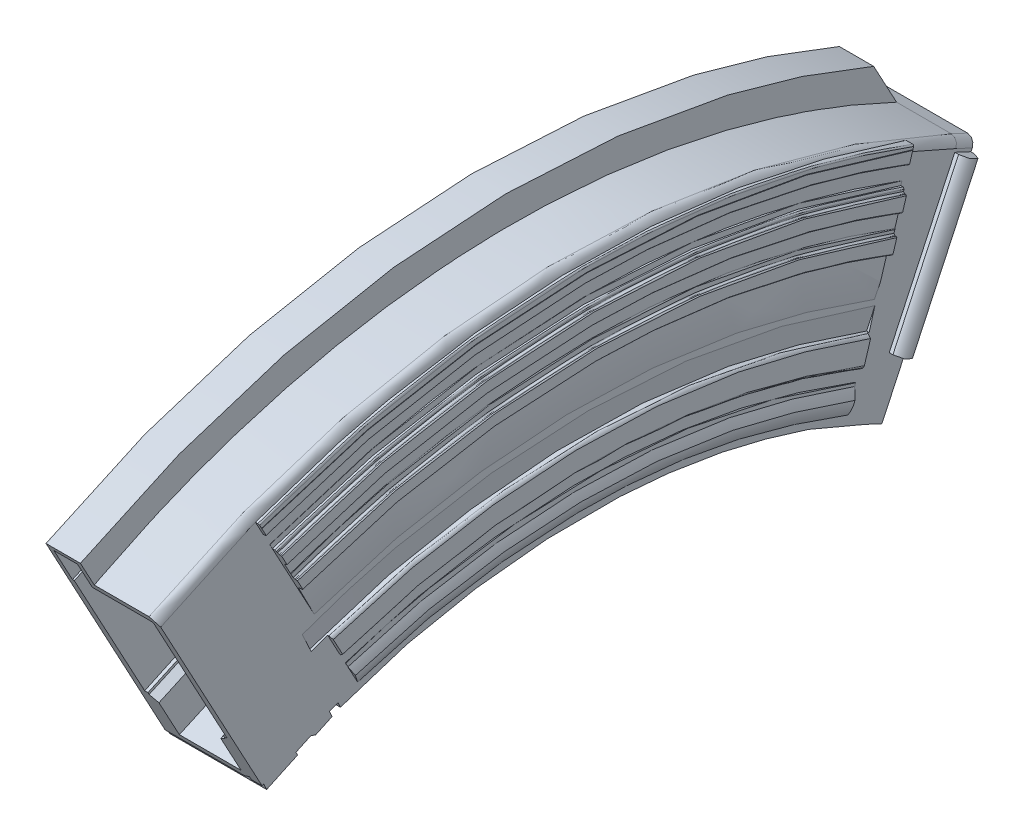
SolidWorks part; units mm, degrees
ref_plane "Front Plane" through (0, 0, 0) normal (0, 0, 1) x (1, 0, 0)
ref_plane "Top Plane" through (0, 0, 0) normal (0, 1, 0) x (1, 0, 0)
ref_plane "Right Plane" through (0, 0, 0) normal (1, 0, 0) x (0, 0, -1)
imported_body "Imported1"
ref_plane "Plane1" through (-25.3777, 0, 0) normal (-1, 0, 0) x (0, 0, 1)
sketch "Sketch1" plane through (-25.3777, 0, 0) normal (-1, 0, 0) x (0, 0, 1)
  line L0 (-115.4013, 84.4642) -> (-62.3327, -24.4482)
  line L1 (85.879, 84.4642) -> (-115.4013, 84.4642)
  line L5 (-62.3327, -24.4482) -> (67.0618, -25.7167)
  line L6 (67.0618, -25.7167) -> (85.879, 84.4642)
extrude "Cut-Extrude2" cut sketch "Sketch1" along normal blind 10
ref_plane "Plane2" through (1.5022, 0, 0) normal (1, 0, 0) x (0, 0, -1)
sketch "Sketch2" plane through (1.5022, 0, 0) normal (1, 0, 0) x (0, 0, -1)
  line L4 (62.3327, -24.4482) -> (115.4013, 84.4642)
  line L5 (-67.0618, -25.7167) -> (62.3327, -24.4482)
  line L6 (-85.879, 84.4642) -> (-67.0618, -25.7167)
  line L7 (115.4013, 84.4642) -> (-85.879, 84.4642)
  line L8 (62.3327, -24.4482) -> (115.4013, 84.4642)
  line L9 (-67.0618, -25.7167) -> (62.3327, -24.4482)
  line L10 (-85.879, 84.4642) -> (-67.0618, -25.7167)
  line L11 (115.4013, 84.4642) -> (-85.879, 84.4642)
  dimension "D1" = 0
extrude "Cut-Extrude3" cut sketch "Sketch2" along normal blind 10
ref_plane "Plane3" through (0, -37.4613, 69.5022) normal (0, -0.4745, 0.8803) x (1, 0, 0)
sketch "Sketch3" plane through (0, -37.4613, 69.5022) normal (0, -0.4745, 0.8803) x (1, 0, 0)
  line L1 (-25.3777, 97.7914) -> (-25.3777, 108.1915)
  line L3 (-25.3777, 108.1915) -> (-15.8527, 108.1915)
  line L4 (-15.8527, 100.0635) -> (-15.8527, 108.1915)
  line L5 (-15.8527, 100.0635) -> (-21.7243, 100.0635)
  line L7 (-16.4978, 100.0635) -> (-7.4978, 100.0635) construction
  line L9 (-21.7243, 100.0635) -> (-25.3777, 97.7914)
  dimension "D2" = 8.128
sketch "Sketch4" plane through (-25.3777, 0, 0) normal (-1, 0, 0) x (0, 0, 1)
  spline S0 degree 2 poles (217.5222, -1918.3619) (528.5417, -111.1256) (90.5708, 60.2304) (77.3085, 65.4192) (63.5341, 69.0398) (49.5686, 72.7106) (35.2681, 74.7187) (20.8682, 76.7408) (6.3292, 77.0486) (-8.2087, 77.3564) (-22.6823, 75.9455) (-37.054, 74.5445) (-51.1633, 71.4679) (-65.0776, 68.4338) (-78.5486, 63.8105) (-523.2936, -88.8257) (-290.1986, -1907.5429) knots -4.08802 -4.08802 -4.08802 0.125 0.125 0.25 0.25 0.375 0.375 0.5 0.5 0.625 0.625 0.75 0.75 0.875 0.875 5.087357 5.087357 5.087357 only from (115.9006, 48.622) to (-104.347, 53.2846) construction
  spline S1 degree 2 poles (115.9006, 48.622) (103.5654, 55.1462) (90.5708, 60.2304) (77.3085, 65.4192) (63.5341, 69.0398) (49.5686, 72.7106) (35.2681, 74.7187) (20.8682, 76.7408) (6.3292, 77.0486) (-8.2087, 77.3564) (-22.6823, 75.9455) (-37.054, 74.5445) (-51.1633, 71.4679) (-65.0776, 68.4338) (-78.5486, 63.8105) (-91.7463, 59.2811) (-104.347, 53.2846) knots 0 0 0 0.125 0.125 0.25 0.25 0.375 0.375 0.5 0.5 0.625 0.625 0.75 0.75 0.875 0.875 1 1 1
sketch "Sketch5" plane through (-25.3777, 0, 0) normal (-1, 0, 0) x (0, 0, 1)
  line L0 (84.8407, 64.8058) -> (80.7077, 78.045)
  line L1 (80.7077, 78.045) -> (122.1902, 60.5092)
  line L2 (122.1902, 60.5092) -> (116.9787, 50.6222)
  arc A0 (116.9787, 50.6222) -> (84.8407, 64.8058) centre (1.134, -168.3638) ccw construction
  arc A1 (116.9787, 50.6222) -> (84.8407, 64.8058) centre (1.134, -168.3638) ccw
extrude "Cut-Extrude4" cut sketch "Sketch5" against normal through all
sweep "Sweep4" add profiles "Sketch3" path "Sketch4"
sketch "Sketch6" plane through (0, 0, 0) normal (1, 0, 0) x (0, 0, -1)
  line L0 (105.3073, 55.3439) -> (95.5176, 73.5067)
  line L1 (95.5176, 73.5067) -> (106.293, 79.3146)
  line L2 (106.293, 79.3146) -> (116.0827, 61.1518)
  line L3 (116.0827, 61.1518) -> (105.3073, 55.3439)
  line L4 (-95.4937, 10.7609) -> (-120.8351, 57.777) construction
extrude "Cut-Extrude5" cut sketch "Sketch6" against normal through all
sketch "Sketch7" plane through (0, -37.4613, 69.5022) normal (0, -0.4745, 0.8803) x (1, 0, 0)
  line L0 (-23.8777, 106.6915) -> (-23.8777, 95.8673)
  line L2 (-17.3527, 95.8673) -> (-17.3527, 106.6915)
  line L4 (-17.3527, 106.6915) -> (-23.8777, 106.6915)
  line L6 (-17.3527, 95.8673) -> (-23.8777, 95.8673)
sketch "Sketch8" plane through (-25.3777, 0, 0) normal (-1, 0, 0) x (0, 0, 1)
  line L0 (120.1234, 56.4566) -> (114.9877, 46.9283) construction
  line L1 (120.1234, 56.4566) -> (114.9877, 46.9283)
  spline S1 degree 3 poles (120.1234, 56.4566) (107.2655, 63.2573) (80.5993, 74.635) (36.7411, 84.9413) (-11.3824, 87.5216) (-58.0414, 80.8774) (-87.1955, 71.1129) (-99.6719, 65.7992) knots 0 0 0 0 0.186667 0.373333 0.56 0.78 0.954113 0.954113 0.954113 0.954113
ref_plane "Plane4" through (-23.8777, 0, 0) normal (-1, 0, 0) x (0, 0, 1)
sketch "Sketch9" plane through (-23.8777, 0, 0) normal (-1, 0, 0) x (0, 0, 1)
  spline S0 degree 3 poles (1467.1093, -1414.6889) (381.43, -552.1429) (356.3336, 9.8397) (36.7411, 84.9413) (-11.3824, 87.5216) (-373.1738, 36.0027) (-419.0478, -643.8914) (-1314.4878, -1520.7567) knots -3.520692 -3.520692 -3.520692 -3.520692 0.186667 0.373333 0.56 0.78 4.876664 4.876664 4.876664 4.876664 only from (120.1234, 56.4566) to (-99.6719, 65.7992) construction
  spline S1 degree 3 poles (120.1234, 56.4566) (107.2655, 63.2573) (80.5993, 74.635) (36.7411, 84.9413) (-11.3824, 87.5216) (-58.0414, 80.8774) (-87.1955, 71.1129) (-99.6719, 65.7992) knots 0 0 0 0 0.186667 0.373333 0.56 0.78 0.954113 0.954113 0.954113 0.954113
sweep "Cut-Sweep3" cut profiles "Sketch7" path "Sketch9"
sketch "Sketch10" plane through (-25.3777, 0, 0) normal (-1, 0, 0) x (0, 0, 1)
  line L0 (-89.3496, 9.2915) -> (-84.6828, -0.7164) construction
  line L1 (70.0327, 6.9164) -> (68.4385, 3.4898) construction
  line L2 (68.4385, 3.4898) -> (72.9948, 1.37) construction
  line L3 (72.9948, 1.37) -> (74.3738, 1.8181) construction
  line L4 (74.3738, 1.8181) -> (78.454, -0.0798) construction
  line L5 (78.454, -0.0798) -> (78.0357, -0.9791) construction
  line L6 (78.0357, -0.9791) -> (86.5796, -4.9532) construction
  line L7 (86.5796, -4.9532) -> (87.3962, -3.1977) construction
  line L8 (87.8437, -3.4322) -> (93.9759, 7.945) construction
  line L9 (93.9759, 7.945) -> (94.7377, 9.3584) construction
  line L10 (-85.9155, 13.631) -> (-86.2185, 14.2807) construction
  line L11 (-90.3077, 11.5829) -> (-85.9155, 13.631) construction
  line L12 (-90.5661, 12.137) -> (-90.3077, 11.5829) construction
  line L13 (-90.5661, 12.137) -> (-90.6553, 12.0916) construction
  line L14 (-90.6553, 12.0916) -> (-90.1912, 11.0964) construction
  line L15 (94.7377, 9.3584) -> (95.4937, 10.7609) construction
  line L16 (-90.1912, 11.0964) -> (-89.3496, 9.2915) construction
  line L17 (-89.3496, 9.2915) -> (-84.6828, -0.7164)
  line L18 (70.0327, 6.9164) -> (68.4385, 3.4898)
  line L19 (68.4385, 3.4898) -> (72.9948, 1.37)
  line L20 (72.9948, 1.37) -> (74.3738, 1.8181)
  line L21 (74.3738, 1.8181) -> (78.454, -0.0798)
  line L22 (78.454, -0.0798) -> (78.0357, -0.9791)
  line L23 (78.0357, -0.9791) -> (86.5796, -4.9532)
  line L24 (86.5796, -4.9532) -> (87.3962, -3.1977)
  line L25 (87.8437, -3.4322) -> (93.9759, 7.945)
  line L26 (93.9759, 7.945) -> (94.7377, 9.3584)
  line L27 (-85.9155, 13.631) -> (-86.2185, 14.2807)
  line L28 (-90.3077, 11.5829) -> (-85.9155, 13.631)
  line L29 (-90.5661, 12.137) -> (-90.3077, 11.5829)
  line L30 (-90.5661, 12.137) -> (-90.6553, 12.0916)
  line L31 (-90.6553, 12.0916) -> (-90.1912, 11.0964)
  line L32 (94.7377, 9.3584) -> (95.4937, 10.7609)
  line L33 (-90.1912, 11.0964) -> (-89.3496, 9.2915)
  arc A0 (87.8437, -3.4322) -> (87.3962, -3.1977) centre (1.134, -168.3638) ccw construction
  arc A1 (87.8437, -3.4322) -> (87.3962, -3.1977) centre (1.134, -168.3638) ccw
  spline S0 degree 2 poles (-200.8077, -1973.8386) (-448.4512, -148.8292) (-70.172, 5.9531) (-59.096, 10.4852) (-47.5026, 13.5834) (-28.1453, 18.7564) (-8.1461, 19.7432) (11.8512, 20.7298) (31.6255, 17.4871) (41.483, 15.8706) (51.1012, 13.224) (448.0782, -96.0109) (362.0888, -1947.6196) knots -5.029672 -5.029672 -5.029672 0.1 0.1 0.25 0.25 0.5 0.5 0.75 0.75 0.875 0.875 6.040096 6.040096 6.040096 only from (-84.6828, -0.7164) to (70.0327, 6.9164) construction
  spline S1 degree 2 poles (98.5134, -1962.4991) (477.82, -135.3858) (74.0561, 20.5054) (63.0235, 24.765) (51.5667, 27.7123) (40.202, 30.636) (28.5654, 32.2273) (16.8648, 33.8273) (5.0505, 34.0563) (-6.7627, 34.2852) (-18.5116, 33.139) (-30.2066, 31.9981) (-41.6673, 29.5186) (-53.225, 27.0182) (-64.4101, 23.191) (-473.0677, -116.6383) (-181.5903, -1956.8715) knots -4.45908 -4.45908 -4.45908 0.125 0.125 0.25 0.25 0.375 0.375 0.5 0.5 0.625 0.625 0.75 0.75 0.875 0.875 5.450003 5.450003 5.450003 only from (95.4937, 10.7609) to (-86.2185, 14.2807) construction
  spline S2 degree 2 poles (-84.6828, -0.7164) (-77.5464, 2.9357) (-70.172, 5.9531) (-59.096, 10.4852) (-47.5026, 13.5834) (-28.1453, 18.7564) (-8.1461, 19.7432) (11.8512, 20.7298) (31.6255, 17.4871) (41.483, 15.8706) (51.1012, 13.224) (60.7084, 10.5804) (70.0327, 6.9164) knots 0 0 0 0.1 0.1 0.25 0.25 0.5 0.5 0.75 0.75 0.875 0.875 1 1 1
  spline S3 degree 2 poles (95.4937, 10.7609) (85.066, 16.2545) (74.0561, 20.5054) (63.0235, 24.765) (51.5667, 27.7123) (40.202, 30.636) (28.5654, 32.2273) (16.8648, 33.8273) (5.0505, 34.0563) (-6.7627, 34.2852) (-18.5116, 33.139) (-30.2066, 31.9981) (-41.6673, 29.5186) (-53.225, 27.0182) (-64.4101, 23.191) (-75.5756, 19.3705) (-86.2185, 14.2807) knots 0 0 0 0.125 0.125 0.25 0.25 0.375 0.375 0.5 0.5 0.625 0.625 0.75 0.75 0.875 0.875 1 1 1
extrude "Boss-Extrude1" add sketch "Sketch10" against normal up to surface (2.9058 mm away)
sketch "Sketch11" plane through (1.5022, 0, 0) normal (1, 0, 0) x (0, 0, -1)
  line L0 (-87.8435, -3.4325) -> (-95.5279, 10.8244)
  line L1 (83.8874, -2.4221) -> (90.7114, 12.2119)
  line L2 (79.3556, -0.3097) -> (83.8874, -2.4221)
  line L3 (-78.0357, -0.9791) -> (-78.454, -0.0798) construction
  line L4 (-78.454, -0.0798) -> (-74.3738, 1.8181) construction
  line L5 (-74.3738, 1.8181) -> (-72.9948, 1.37) construction
  line L6 (-72.9948, 1.37) -> (-68.4385, 3.4898) construction
  line L8 (-87.8574, -2.2061) -> (-86.5796, -4.9532) construction
  line L9 (-86.5796, -4.9532) -> (-78.0357, -0.9791) construction
  line L10 (-87.8435, -3.4325) -> (-87.396, -3.1981)
  line L11 (-69.1872, 5.0991) -> (-68.4385, 3.4898)
  line L26 (-78.0357, -0.9791) -> (-78.454, -0.0798)
  line L27 (-78.454, -0.0798) -> (-74.3738, 1.8181)
  line L28 (-74.3738, 1.8181) -> (-72.9948, 1.37)
  line L29 (-72.9948, 1.37) -> (-68.4385, 3.4898)
  line L31 (-87.396, -3.1981) -> (-86.5796, -4.9532)
  line L32 (-86.5796, -4.9532) -> (-78.0357, -0.9791)
  line L34 (90.7114, 12.2119) -> (86.2489, 14.3461)
  spline S0 degree 3 poles (1622.9384, -883.8935) (-402.81, -635.4754) (-297.3004, -56.6568) (-34.8478, 15.6256) (-18.5107, 17.88) (14.1899, 18.0601) (30.5508, 15.9857) (293.5161, -53.3314) (405.4192, -629.7756) (-1610.6775, -900.857) knots -3.741914 -3.741914 -3.741914 -3.741914 0.170403 0.170403 0.420403 0.420403 0.670403 0.670403 4.578491 4.578491 4.578491 4.578491 weights 1 1 1 1 1 1 1 1 1 1 only from (-69.1872, 5.0991) to (79.3556, -0.3097) construction
  spline S2 degree 3 poles (69.8559, -1957.0512) (329.8702, -796.8684) (352.2471, -93.7745) (71.26, 20.8376) (67.0965, 22.3794) (58.6348, 25.1977) (54.338, 26.4723) (41.4321, 29.8424) (32.7458, 31.5079) (15.212, 33.6989) (6.3644, 34.2245) (-7.032, 34.1298) (-11.5009, 33.9496) (-20.3572, 33.3009) (-24.7578, 32.8324) (-37.8789, 31.001) (-46.5185, 29.2142) (-59.3153, 25.68) (-63.5537, 24.3592) (-71.9749, 21.4254) (-76.1566, 19.8113) (-383.7759, -110.7286) (-288.4616, -941.1838) (-81.1689, -1964.1016) knots -4.121511 -4.121511 -4.121511 -4.121511 0.101632 0.101632 0.164132 0.164132 0.226632 0.226632 0.351632 0.351632 0.476632 0.476632 0.539132 0.539132 0.601632 0.601632 0.726632 0.726632 0.789132 0.789132 0.851632 0.851632 5.486098 5.486098 5.486098 5.486098 weights 1 1 1 1 1 1 1 1 1 1 1 1 1 1 1 1 1 1 1 1 1 1 1 1 only from (86.2489, 14.3461) to (-95.5279, 10.8244) construction
  spline S4 degree 3 poles (-69.1872, 5.0991) (-63.1093, 7.4841) (-56.9063, 9.5505) (-34.8478, 15.6256) (-18.5107, 17.88) (14.1899, 18.0601) (30.5508, 15.9857) (57.7087, 8.827) (68.7711, 4.758) (79.3556, -0.3097) knots 0.07057 0.07057 0.07057 0.07057 0.170403 0.170403 0.420403 0.420403 0.670403 0.670403 0.849833 0.849833 0.849833 0.849833 weights 1 1 1 1 1 1 1 1 1 1
  spline S6 degree 3 poles (86.2489, 14.3461) (82.6714, 16.057) (79.0411, 17.6638) (71.26, 20.8376) (67.0965, 22.3794) (58.6348, 25.1977) (54.338, 26.4723) (41.4321, 29.8424) (32.7458, 31.5079) (15.212, 33.6989) (6.3644, 34.2245) (-7.032, 34.1298) (-11.5009, 33.9496) (-20.3572, 33.3009) (-24.7578, 32.8324) (-37.8789, 31.001) (-46.5185, 29.2142) (-59.3153, 25.68) (-63.5537, 24.3592) (-71.9749, 21.4254) (-76.1566, 19.8113) (-85.4596, 15.8635) (-90.5518, 13.446) (-95.5279, 10.8244) knots 0.045455 0.045455 0.045455 0.045455 0.101632 0.101632 0.164132 0.164132 0.226632 0.226632 0.351632 0.351632 0.476632 0.476632 0.539132 0.539132 0.601632 0.601632 0.726632 0.726632 0.789132 0.789132 0.851632 0.851632 0.931178 0.931178 0.931178 0.931178 weights 1 1 1 1 1 1 1 1 1 1 1 1 1 1 1 1 1 1 1 1 1 1 1 1
extrude "Boss-Extrude3" add sketch "Sketch11" against normal up to surface (2.974 mm away)
ref_plane "Plane5" through (0, -24.4829, 52.6227) normal (0, 0.4218, -0.9067) x (-1, 0, 0)
sketch "Sketch12" plane through (0, -24.4829, 52.6227) normal (0, 0.4218, -0.9067) x (-1, 0, 0)
  line L0 (11.9378, 32.0311) -> (11.9378, 129.7323) construction
  line L1 (25.3777, 32.0311) -> (-1.5022, 32.0311) construction
  line L2 (-1.5022, 32.0337) -> (-1.5022, 33.8087) construction
  line L3 (-1.5022, 32.0337) -> (-1.5022, 33.8087)
  line L4 (-1.5022, 50.1111) -> (-1.5022, 33.9431) construction
  line L5 (-1.5022, 40.9334) -> (-1.5022, 44.1084)
  line L6 (-1.5022, 58.9674) -> (-1.9825, 63.0338)
  line L7 (-1.5022, 93.047) -> (-1.5022, 50.1111) construction
  line L8 (-0.7522, 52.6174) -> (-1.7522, 52.6174)
  line L9 (-2.7522, 51.6174) -> (-2.7522, 45.1084)
  line L10 (-1.7522, 44.1084) -> (-1.5022, 44.1084)
  line L11 (-0.7522, 52.6174) -> (-1.5022, 58.9674)
  line L12 (-1.5022, 93.047) -> (-2.1522, 93.047)
  line L13 (-2.5022, 92.697) -> (-2.5022, 88.952)
  line L14 (-2.1522, 88.602) -> (-1.5022, 88.602)
  line L15 (-1.5022, 88.602) -> (-1.5022, 84.792)
  line L16 (-1.5022, 84.792) -> (-2.1522, 84.792)
  line L17 (-2.5022, 84.442) -> (-2.5022, 83.9783)
  line L18 (-2.8522, 83.6283) -> (-3.1522, 83.6283)
  line L19 (-3.5022, 83.2783) -> (-3.5022, 78.8983)
  line L20 (-3.1522, 78.5483) -> (-2.8522, 78.5483)
  line L21 (-2.5022, 78.1983) -> (-2.5022, 74.8343)
  line L22 (-2.8522, 74.4843) -> (-3.1522, 74.4843)
  line L23 (-3.5022, 74.1343) -> (-3.5022, 69.7543)
  line L24 (-3.1522, 69.4043) -> (-2.3349, 69.4043)
  line L25 (-1.9849, 69.0543) -> (-1.9849, 63.0749)
  line L26 (-1.5022, 32.0337) -> (0.4292, 32.0311)
  line L27 (0.4292, 32.0311) -> (0.4978, 93.047)
  line L28 (0.4978, 93.047) -> (-1.5022, 93.047)
  line L29 (24.3777, 93.047) -> (25.3777, 93.047)
  line L32 (25.8604, 69.0543) -> (25.8604, 63.0749)
  line L33 (27.0277, 69.4043) -> (26.2104, 69.4043)
  line L34 (27.3777, 74.1343) -> (27.3777, 69.7543)
  line L35 (26.7277, 74.4843) -> (27.0277, 74.4843)
  line L36 (26.3777, 78.1983) -> (26.3777, 74.8343)
  line L37 (27.0277, 78.5483) -> (26.7277, 78.5483)
  line L38 (27.3777, 83.2783) -> (27.3777, 78.8983)
  line L39 (26.7277, 83.6283) -> (27.0277, 83.6283)
  line L40 (26.3777, 84.442) -> (26.3777, 83.9783)
  line L41 (25.3777, 84.792) -> (26.0277, 84.792)
  line L42 (25.3777, 88.602) -> (25.3777, 84.792)
  line L43 (26.0277, 88.602) -> (25.3777, 88.602)
  line L44 (26.3777, 92.697) -> (26.3777, 88.952)
  line L45 (25.3777, 93.047) -> (26.0277, 93.047)
  line L46 (24.6277, 52.6174) -> (25.3777, 58.9674)
  line L47 (25.6277, 44.1084) -> (25.3777, 44.1084)
  line L48 (26.6277, 51.6174) -> (26.6277, 45.1084)
  line L49 (24.6277, 52.6174) -> (25.6277, 52.6174)
  line L50 (25.3777, 58.9674) -> (25.858, 63.0338)
  line L51 (25.3777, 40.9334) -> (25.3777, 44.1084)
  line L53 (24.3777, 93.047) -> (24.3777, 33.8087)
  line L54 (24.3777, 33.8087) -> (25.3777, 33.8087)
  arc A0 (-1.5022, 33.8087) -> (-1.5022, 40.9334) centre (5.0978, 37.371) cw
  arc A1 (-1.7522, 52.6174) -> (-2.7522, 51.6174) centre (-1.7522, 51.6174) ccw
  arc A2 (-2.7522, 45.1084) -> (-1.7522, 44.1084) centre (-1.7522, 45.1084) ccw
  arc A3 (-1.9849, 63.0749) -> (-1.9825, 63.0338) centre (-1.6349, 63.0749) ccw
  arc A4 (-2.3349, 69.4043) -> (-1.9849, 69.0543) centre (-2.3349, 69.0543) cw
  arc A5 (-3.5022, 69.7543) -> (-3.1522, 69.4043) centre (-3.1522, 69.7543) ccw
  arc A6 (-2.5022, 74.8343) -> (-2.8522, 74.4843) centre (-2.8522, 74.8343) cw
  arc A7 (-2.8522, 78.5483) -> (-2.5022, 78.1983) centre (-2.8522, 78.1983) cw
  arc A8 (-2.8522, 83.6283) -> (-2.5022, 83.9783) centre (-2.8522, 83.9783) ccw
  arc A9 (-3.1522, 74.4843) -> (-3.5022, 74.1343) centre (-3.1522, 74.1343) ccw
  arc A10 (-3.5022, 78.8983) -> (-3.1522, 78.5483) centre (-3.1522, 78.8983) ccw
  arc A11 (-3.1522, 83.6283) -> (-3.5022, 83.2783) centre (-3.1522, 83.2783) ccw
  arc A12 (-2.1522, 84.792) -> (-2.5022, 84.442) centre (-2.1522, 84.442) ccw
  arc A13 (-2.5022, 92.697) -> (-2.1522, 93.047) centre (-2.1522, 92.697) cw
  arc A14 (-2.5022, 88.952) -> (-2.1522, 88.602) centre (-2.1522, 88.952) ccw
  arc A15 (26.3777, 88.952) -> (26.0277, 88.602) centre (26.0277, 88.952) cw
  arc A16 (26.3777, 92.697) -> (26.0277, 93.047) centre (26.0277, 92.697) ccw
  arc A17 (26.0277, 84.792) -> (26.3777, 84.442) centre (26.0277, 84.442) cw
  arc A18 (27.0277, 83.6283) -> (27.3777, 83.2783) centre (27.0277, 83.2783) cw
  arc A19 (27.3777, 78.8983) -> (27.0277, 78.5483) centre (27.0277, 78.8983) cw
  arc A20 (27.0277, 74.4843) -> (27.3777, 74.1343) centre (27.0277, 74.1343) cw
  arc A21 (26.7277, 83.6283) -> (26.3777, 83.9783) centre (26.7277, 83.9783) cw
  arc A22 (26.7277, 78.5483) -> (26.3777, 78.1983) centre (26.7277, 78.1983) ccw
  arc A23 (26.3777, 74.8343) -> (26.7277, 74.4843) centre (26.7277, 74.8343) ccw
  arc A24 (27.3777, 69.7543) -> (27.0277, 69.4043) centre (27.0277, 69.7543) cw
  arc A25 (26.2104, 69.4043) -> (25.8604, 69.0543) centre (26.2104, 69.0543) ccw
  arc A26 (25.8604, 63.0749) -> (25.858, 63.0338) centre (25.5104, 63.0749) cw
  arc A27 (26.6277, 45.1084) -> (25.6277, 44.1084) centre (25.6277, 45.1084) cw
  arc A28 (25.6277, 52.6174) -> (26.6277, 51.6174) centre (25.6277, 51.6174) cw
  arc A29 (25.3777, 33.8087) -> (25.3777, 40.9334) centre (18.7777, 37.371) ccw
  point P39 (-1.9849, 63.0543)
  point P42 (-1.9849, 69.4043)
  point P45 (-3.5022, 69.4043)
  point P54 (-3.5022, 74.4843)
  point P57 (-3.5022, 78.5483)
  point P60 (-3.5022, 83.6283)
  point P65 (-2.5022, 93.047)
  point P68 (-2.5022, 88.602)
  point P126 (26.3777, 88.602)
  point P127 (26.3777, 93.047)
  point P128 (27.3777, 83.6283)
  point P129 (27.3777, 78.5483)
  point P130 (27.3777, 74.4843)
  point P131 (27.3777, 69.4043)
  point P132 (25.8604, 69.4043)
  point P133 (25.8604, 63.0543)
  dimension "D2" = 7.5
  dimension "D5" = 0.75
  dimension "D6" = 1.25
  dimension "D7" = 1
  dimension "D20" = 0.35
  dimension "D1" = 7.1247
  dimension "D3" = 3.175
  dimension "D4" = 8.509
  dimension "D8" = 6.35
  dimension "D9" = 6.35
  dimension "D10" = 5.08
  dimension "D11" = 5.08
  dimension "D12" = 2
  dimension "D13" = 1
  dimension "D14" = 1
  dimension "D15" = 2
  dimension "D16" = 4.064
  dimension "D17" = 3.81
  dimension "D18" = 4.445
  dimension "D19" = 1
ref_plane "Plane6" through (-24.3777, 0, 0) normal (-1, 0, 0) x (0, 0, 1)
sketch "Sketch13" plane through (-24.3777, 0, 0) normal (-1, 0, 0) x (0, 0, 1)
  spline S1 degree 3 poles (91.8729, 59.8804) (78.3096, 65.1821) (50.4905, 73.4654) (5.6927, 78.727) (-42.4687, 75.8184) (-74.7936, 67.3806) (-91.4406, 61.1688) (-91.7767, 61.0426) knots 0 0 0 0 0.186667 0.373333 0.56 0.78 0.784538 0.784538 0.784538 0.784538
sweep "Sweep6" add profiles "Sketch12" path "Sketch13"
sketch "Sketch14" plane through (0, -37.4613, 69.5022) normal (0, -0.4745, 0.8803) x (1, 0, 0)
  line L0 (-11.9097, 40.6574) -> (-11.9097, 118.7762) construction
  line L1 (-20.4719, 40.6574) -> (-3.3475, 40.6574) construction
  line L2 (1.5584, 96.3016) -> (2.2084, 96.3016)
  line L3 (-26.0277, 96.3016) -> (-28.1288, 96.3016)
  line L4 (2.5584, 95.9522) -> (2.5584, 92.2137)
  line L5 (-25.3777, 37.1659) -> (-28.1288, 37.1659)
  line L6 (-28.1288, 96.3016) -> (-28.1288, 37.1659)
  line L7 (2.2084, 91.8643) -> (1.5584, 91.8643)
  line L8 (1.5584, 91.8643) -> (1.5584, 88.0609)
  line L9 (1.5584, 88.0609) -> (2.2084, 88.0609)
  line L10 (2.5584, 87.7115) -> (2.5584, 87.2486)
  line L11 (2.9084, 86.8992) -> (3.2084, 86.8992)
  line L12 (3.5584, 86.5498) -> (3.5584, 82.1774)
  line L13 (3.2084, 81.828) -> (2.9084, 81.828)
  line L14 (2.5584, 81.4786) -> (2.5584, 78.1205)
  line L15 (2.9084, 77.7711) -> (3.2084, 77.7711)
  line L16 (3.5584, 77.4217) -> (3.5584, 73.0493)
  line L17 (3.2084, 72.6999) -> (2.3911, 72.6999)
  line L18 (2.0411, 72.3505) -> (2.0411, 66.3814)
  line L19 (2.0387, 66.3405) -> (1.5584, 62.281)
  line L20 (1.5584, 62.281) -> (0.8084, 55.942)
  line L21 (0.8084, 55.942) -> (1.8084, 55.942)
  line L22 (2.8084, 54.9438) -> (2.8084, 48.4461)
  line L23 (-24.3777, 37.1659) -> (-24.3777, 96.3016)
  line L24 (1.8084, 47.4478) -> (1.5584, 47.4478)
  line L25 (1.5584, 47.4478) -> (1.5584, 44.2783)
  line L26 (4.3095, 96.3016) -> (4.3095, 37.1659)
  line L27 (1.5584, 37.1659) -> (4.3095, 37.1659)
  line L28 (1.5584, 96.3016) -> (4.3095, 96.3016)
  line L72 (-25.3777, 37.1659) -> (-24.3777, 37.1659)
  line L73 (-25.3777, 47.4478) -> (-25.3777, 44.2783)
  line L74 (-25.6277, 47.4478) -> (-25.3777, 47.4478)
  line L75 (-26.6277, 54.9438) -> (-26.6277, 48.4461)
  line L76 (-24.6277, 55.942) -> (-25.6277, 55.942)
  line L77 (-25.3777, 62.281) -> (-24.6277, 55.942)
  line L78 (-25.858, 66.3405) -> (-25.3777, 62.281)
  line L79 (-25.8604, 72.3505) -> (-25.8604, 66.3814)
  line L80 (-27.0277, 72.6999) -> (-26.2104, 72.6999)
  line L81 (-27.3777, 77.4217) -> (-27.3777, 73.0493)
  line L82 (-26.7277, 77.7711) -> (-27.0277, 77.7711)
  line L83 (-26.3777, 81.4786) -> (-26.3777, 78.1205)
  line L84 (-27.0277, 81.828) -> (-26.7277, 81.828)
  line L85 (-27.3777, 86.5498) -> (-27.3777, 82.1774)
  line L86 (-26.7277, 86.8992) -> (-27.0277, 86.8992)
  line L87 (-26.3777, 87.7115) -> (-26.3777, 87.2486)
  line L88 (-25.3777, 88.0609) -> (-26.0277, 88.0609)
  line L89 (-25.3777, 91.8643) -> (-25.3777, 88.0609)
  line L90 (-26.0277, 91.8643) -> (-25.3777, 91.8643)
  line L91 (-26.3777, 95.9522) -> (-26.3777, 92.2137)
  line L92 (-25.3777, 96.3016) -> (-26.0277, 96.3016)
  line L93 (-24.3777, 96.3016) -> (-25.3777, 96.3016)
  line L96 (-25.3777, 47.4478) -> (-25.3777, 44.2783)
  line L97 (-25.6277, 47.4478) -> (-25.3777, 47.4478)
  line L98 (-26.6277, 54.9438) -> (-26.6277, 48.4461)
  line L99 (-24.6277, 55.942) -> (-25.6277, 55.942)
  line L100 (-25.3777, 62.281) -> (-24.6277, 55.942)
  line L101 (-25.858, 66.3405) -> (-25.3777, 62.281)
  line L102 (-25.8604, 72.3505) -> (-25.8604, 66.3814)
  line L103 (-27.0277, 72.6999) -> (-26.2104, 72.6999)
  line L104 (-27.3777, 77.4217) -> (-27.3777, 73.0493)
  line L105 (-26.7277, 77.7711) -> (-27.0277, 77.7711)
  line L106 (-26.3777, 81.4786) -> (-26.3777, 78.1205)
  line L107 (-27.0277, 81.828) -> (-26.7277, 81.828)
  line L108 (-27.3777, 86.5498) -> (-27.3777, 82.1774)
  line L109 (-26.7277, 86.8992) -> (-27.0277, 86.8992)
  line L110 (-26.3777, 87.7115) -> (-26.3777, 87.2486)
  line L111 (-25.3777, 88.0609) -> (-26.0277, 88.0609)
  line L112 (-25.3777, 91.8643) -> (-25.3777, 88.0609)
  line L113 (-26.0277, 91.8643) -> (-25.3777, 91.8643)
  line L114 (-26.3777, 95.9522) -> (-26.3777, 92.2137)
  ellipse E0 centre (2.2084, 95.9522) end of major axis (2.5584, 95.9522) minor radius 0.3494 (2.2084, 96.3016) -> (2.5584, 95.9522) cw
  ellipse E1 centre (2.2084, 92.2137) end of major axis (1.8584, 92.2137) minor radius 0.3494 (2.5584, 92.2137) -> (2.2084, 91.8643) cw
  ellipse E2 centre (2.2084, 87.7115) end of major axis (1.8584, 87.7115) minor radius 0.3494 (2.2084, 88.0609) -> (2.5584, 87.7115) cw
  ellipse E3 centre (2.9084, 87.2486) end of major axis (2.5584, 87.2486) minor radius 0.3494 (2.9084, 86.8992) -> (2.5584, 87.2486) cw
  ellipse E4 centre (3.2084, 86.5498) end of major axis (2.8584, 86.5498) minor radius 0.3494 (3.2084, 86.8992) -> (3.5584, 86.5498) cw
  ellipse E5 centre (3.2084, 82.1774) end of major axis (2.8584, 82.1774) minor radius 0.3494 (3.5584, 82.1774) -> (3.2084, 81.828) cw
  ellipse E6 centre (2.9084, 81.4786) end of major axis (3.2584, 81.4786) minor radius 0.3494 (2.5584, 81.4786) -> (2.9084, 81.828) cw
  ellipse E7 centre (2.9084, 78.1205) end of major axis (3.2584, 78.1205) minor radius 0.3494 (2.9084, 77.7711) -> (2.5584, 78.1205) cw
  ellipse E8 centre (3.2084, 77.4217) end of major axis (2.8584, 77.4217) minor radius 0.3494 (3.2084, 77.7711) -> (3.5584, 77.4217) cw
  ellipse E9 centre (3.2084, 73.0493) end of major axis (2.8584, 73.0493) minor radius 0.3494 (3.5584, 73.0493) -> (3.2084, 72.6999) cw
  ellipse E10 centre (2.3911, 72.3505) end of major axis (2.7411, 72.3505) minor radius 0.3494 (2.0411, 72.3505) -> (2.3911, 72.6999) cw
  ellipse E11 centre (1.6911, 66.3814) end of major axis (1.3411, 66.3814) minor radius 0.3494 (2.0411, 66.3814) -> (2.0387, 66.3405) cw
  ellipse E12 centre (1.8084, 54.9438) end of major axis (0.8084, 54.9438) minor radius 0.9983 (1.8084, 55.942) -> (2.8084, 54.9438) cw
  ellipse E13 centre (1.8084, 48.4461) end of major axis (0.8084, 48.4461) minor radius 0.9983 (2.8084, 48.4461) -> (1.8084, 47.4478) cw
  ellipse E14 centre (-5.0416, 40.7221) end of major axis (2.4584, 40.7221) minor radius 7.487 (1.5584, 44.2783) -> (1.5584, 37.1659) cw
  ellipse E45 centre (-18.7777, 40.7221) end of major axis (-26.2777, 40.7221) minor radius 7.487 (-25.3777, 44.2783) -> (-25.3777, 37.1659) ccw
  ellipse E46 centre (-25.6277, 48.4461) end of major axis (-24.6277, 48.4461) minor radius 0.9983 (-26.6277, 48.4461) -> (-25.6277, 47.4478) ccw
  ellipse E47 centre (-25.6277, 54.9438) end of major axis (-24.6277, 54.9438) minor radius 0.9983 (-25.6277, 55.942) -> (-26.6277, 54.9438) ccw
  ellipse E48 centre (-25.5104, 66.3814) end of major axis (-25.1604, 66.3814) minor radius 0.3494 (-25.8604, 66.3814) -> (-25.858, 66.3405) ccw
  ellipse E49 centre (-26.2104, 72.3505) end of major axis (-26.5604, 72.3505) minor radius 0.3494 (-25.8604, 72.3505) -> (-26.2104, 72.6999) ccw
  ellipse E50 centre (-27.0277, 73.0493) end of major axis (-26.6777, 73.0493) minor radius 0.3494 (-27.3777, 73.0493) -> (-27.0277, 72.6999) ccw
  ellipse E51 centre (-27.0277, 77.4217) end of major axis (-26.6777, 77.4217) minor radius 0.3494 (-27.0277, 77.7711) -> (-27.3777, 77.4217) ccw
  ellipse E52 centre (-26.7277, 78.1205) end of major axis (-27.0777, 78.1205) minor radius 0.3494 (-26.7277, 77.7711) -> (-26.3777, 78.1205) ccw
  ellipse E53 centre (-26.7277, 81.4786) end of major axis (-27.0777, 81.4786) minor radius 0.3494 (-26.3777, 81.4786) -> (-26.7277, 81.828) ccw
  ellipse E54 centre (-27.0277, 82.1774) end of major axis (-26.6777, 82.1774) minor radius 0.3494 (-27.3777, 82.1774) -> (-27.0277, 81.828) ccw
  ellipse E55 centre (-27.0277, 86.5498) end of major axis (-26.6777, 86.5498) minor radius 0.3494 (-27.0277, 86.8992) -> (-27.3777, 86.5498) ccw
  ellipse E56 centre (-26.7277, 87.2486) end of major axis (-26.3777, 87.2486) minor radius 0.3494 (-26.7277, 86.8992) -> (-26.3777, 87.2486) ccw
  ellipse E57 centre (-26.0277, 87.7115) end of major axis (-25.6777, 87.7115) minor radius 0.3494 (-26.0277, 88.0609) -> (-26.3777, 87.7115) ccw
  ellipse E58 centre (-26.0277, 92.2137) end of major axis (-25.6777, 92.2137) minor radius 0.3494 (-26.3777, 92.2137) -> (-26.0277, 91.8643) ccw
  ellipse E59 centre (-26.0277, 95.9522) end of major axis (-26.3777, 95.9522) minor radius 0.3494 (-26.0277, 96.3016) -> (-26.3777, 95.9522) ccw
  ellipse E60 centre (-18.7777, 40.7221) end of major axis (-26.2777, 40.7221) minor radius 7.487 (-25.3777, 44.2783) -> (-25.3777, 37.1659) ccw
  ellipse E61 centre (-25.6277, 48.4461) end of major axis (-24.6277, 48.4461) minor radius 0.9983 (-26.6277, 48.4461) -> (-25.6277, 47.4478) ccw
  ellipse E62 centre (-25.6277, 54.9438) end of major axis (-24.6277, 54.9438) minor radius 0.9983 (-25.6277, 55.942) -> (-26.6277, 54.9438) ccw
  ellipse E63 centre (-25.5104, 66.3814) end of major axis (-25.1604, 66.3814) minor radius 0.3494 (-25.8604, 66.3814) -> (-25.858, 66.3405) ccw
  ellipse E64 centre (-26.2104, 72.3505) end of major axis (-26.5604, 72.3505) minor radius 0.3494 (-25.8604, 72.3505) -> (-26.2104, 72.6999) ccw
  ellipse E65 centre (-27.0277, 73.0493) end of major axis (-26.6777, 73.0493) minor radius 0.3494 (-27.3777, 73.0493) -> (-27.0277, 72.6999) ccw
  ellipse E66 centre (-27.0277, 77.4217) end of major axis (-26.6777, 77.4217) minor radius 0.3494 (-27.0277, 77.7711) -> (-27.3777, 77.4217) ccw
  ellipse E67 centre (-26.7277, 78.1205) end of major axis (-27.0777, 78.1205) minor radius 0.3494 (-26.7277, 77.7711) -> (-26.3777, 78.1205) ccw
  ellipse E68 centre (-26.7277, 81.4786) end of major axis (-27.0777, 81.4786) minor radius 0.3494 (-26.3777, 81.4786) -> (-26.7277, 81.828) ccw
  ellipse E69 centre (-27.0277, 82.1774) end of major axis (-26.6777, 82.1774) minor radius 0.3494 (-27.3777, 82.1774) -> (-27.0277, 81.828) ccw
  ellipse E70 centre (-27.0277, 86.5498) end of major axis (-26.6777, 86.5498) minor radius 0.3494 (-27.0277, 86.8992) -> (-27.3777, 86.5498) ccw
  ellipse E71 centre (-26.7277, 87.2486) end of major axis (-26.3777, 87.2486) minor radius 0.3494 (-26.7277, 86.8992) -> (-26.3777, 87.2486) ccw
  ellipse E72 centre (-26.0277, 87.7115) end of major axis (-25.6777, 87.7115) minor radius 0.3494 (-26.0277, 88.0609) -> (-26.3777, 87.7115) ccw
  ellipse E73 centre (-26.0277, 92.2137) end of major axis (-25.6777, 92.2137) minor radius 0.3494 (-26.3777, 92.2137) -> (-26.0277, 91.8643) ccw
  ellipse E74 centre (-26.0277, 95.9522) end of major axis (-26.3777, 95.9522) minor radius 0.3494 (-26.0277, 96.3016) -> (-26.3777, 95.9522) ccw
  point P145 (0, 0)
  dimension "D2" = 0
ref_plane "Plane7" through (-26.3777, 0, 0) normal (-1, 0, 0) x (0, 0, 1)
sketch "Sketch20" plane through (0, -24.4829, 52.6227) normal (0, 0.4218, -0.9067) x (-1, 0, 0)
  line L0 (11.9097, 40.6574) -> (11.9097, 118.7762) construction
  line L1 (-2.2457, 91.5883) -> (-4.3093, 91.5883)
  line L2 (-4.3093, 91.5883) -> (-4.3093, 32.4527)
  line L3 (26.3777, 91.2409) -> (26.3777, 87.5024)
  line L4 (26.0277, 87.153) -> (25.3777, 87.153)
  line L5 (25.3777, 87.153) -> (25.3777, 83.3496)
  line L6 (25.3777, 83.3496) -> (26.0277, 83.3496)
  line L7 (26.3777, 83.0002) -> (26.3777, 82.5373)
  line L8 (26.7277, 82.1879) -> (27.0277, 82.1879)
  line L9 (27.3777, 81.8385) -> (27.3777, 77.4661)
  line L10 (27.0277, 77.1167) -> (26.7277, 77.1167)
  line L11 (26.3777, 76.7673) -> (26.3777, 73.4092)
  line L12 (26.7277, 73.0598) -> (27.0277, 73.0598)
  line L13 (27.3777, 72.7104) -> (27.3777, 68.338)
  line L14 (27.0277, 67.9886) -> (26.2104, 67.9886)
  line L15 (25.8604, 67.6392) -> (25.8604, 61.6701)
  line L16 (25.858, 61.6292) -> (25.3777, 57.5697)
  line L17 (25.3777, 57.5697) -> (24.6277, 51.2307)
  line L18 (24.6277, 51.2307) -> (25.6277, 51.2307)
  line L19 (26.6277, 50.2325) -> (26.6277, 43.7348)
  line L20 (25.6277, 42.7365) -> (25.3776, 42.7365)
  line L21 (25.3776, 42.7365) -> (25.3776, 39.565)
  line L22 (25.3776, 32.4527) -> (28.1287, 32.4527)
  line L23 (28.1287, 91.5883) -> (28.1287, 32.4527)
  line L24 (26.065, 91.5883) -> (28.1287, 91.5883)
  line L66 (-1.5583, 32.4527) -> (-4.3093, 32.4527)
  line L68 (-1.5583, 42.7365) -> (-1.5583, 39.565)
  line L69 (-1.8084, 42.7365) -> (-1.5583, 42.7365)
  line L70 (-2.8084, 50.2325) -> (-2.8084, 43.7348)
  line L71 (-0.8084, 51.2307) -> (-1.8084, 51.2307)
  line L72 (-1.5584, 57.5697) -> (-0.8084, 51.2307)
  line L73 (-2.0387, 61.6292) -> (-1.5584, 57.5697)
  line L74 (-2.0411, 67.6392) -> (-2.0411, 61.6701)
  line L75 (-3.2084, 67.9886) -> (-2.3911, 67.9886)
  line L76 (-3.5584, 72.7104) -> (-3.5584, 68.338)
  line L77 (-2.9084, 73.0598) -> (-3.2084, 73.0598)
  line L78 (-2.5584, 76.7673) -> (-2.5584, 73.4092)
  line L79 (-3.2084, 77.1167) -> (-2.9084, 77.1167)
  line L80 (-3.5584, 81.8385) -> (-3.5584, 77.4661)
  line L81 (-2.9084, 82.1879) -> (-3.2084, 82.1879)
  line L82 (-2.5584, 83.0002) -> (-2.5584, 82.5373)
  line L83 (-1.5584, 83.3496) -> (-2.2084, 83.3496)
  line L84 (-1.5584, 87.153) -> (-1.5584, 83.3496)
  line L85 (-2.2084, 87.153) -> (-1.5584, 87.153)
  line L88 (-2.5584, 91.2409) -> (-2.5584, 87.5024)
  arc A1 (26.065, 91.5883) -> (26.3777, 91.2409) centre (26.0466, 91.2574) cw
  arc A2 (-2.2457, 91.5883) -> (-2.5584, 91.2409) centre (-2.2283, 91.2583) ccw
  ellipse E0 centre (26.0277, 87.5024) end of major axis (25.6777, 87.5024) minor radius 0.3494 (26.3777, 87.5024) -> (26.0277, 87.153) cw
  ellipse E1 centre (26.0277, 83.0002) end of major axis (25.6777, 83.0002) minor radius 0.3494 (26.0277, 83.3496) -> (26.3777, 83.0002) cw
  ellipse E2 centre (26.7277, 82.5373) end of major axis (26.3777, 82.5373) minor radius 0.3494 (26.7277, 82.1879) -> (26.3777, 82.5373) cw
  ellipse E3 centre (27.0277, 81.8385) end of major axis (26.6777, 81.8385) minor radius 0.3494 (27.0277, 82.1879) -> (27.3777, 81.8385) cw
  ellipse E4 centre (27.0277, 77.4661) end of major axis (26.6777, 77.4661) minor radius 0.3494 (27.3777, 77.4661) -> (27.0277, 77.1167) cw
  ellipse E5 centre (26.7277, 76.7673) end of major axis (27.0777, 76.7673) minor radius 0.3494 (26.3777, 76.7673) -> (26.7277, 77.1167) cw
  ellipse E6 centre (26.7277, 73.4092) end of major axis (27.0777, 73.4092) minor radius 0.3494 (26.7277, 73.0598) -> (26.3777, 73.4092) cw
  ellipse E7 centre (27.0277, 72.7104) end of major axis (26.6777, 72.7104) minor radius 0.3494 (27.0277, 73.0598) -> (27.3777, 72.7104) cw
  ellipse E8 centre (27.0277, 68.338) end of major axis (26.6777, 68.338) minor radius 0.3494 (27.3777, 68.338) -> (27.0277, 67.9886) cw
  ellipse E9 centre (26.2104, 67.6392) end of major axis (26.5604, 67.6392) minor radius 0.3494 (25.8604, 67.6392) -> (26.2104, 67.9886) cw
  ellipse E11 centre (25.6277, 50.2325) end of major axis (24.6277, 50.2325) minor radius 0.9983 (25.6277, 51.2307) -> (26.6277, 50.2325) cw
  ellipse E12 centre (25.6277, 43.7348) end of major axis (24.6277, 43.7348) minor radius 0.9983 (26.6277, 43.7348) -> (25.6277, 42.7365) cw
  ellipse E13 centre (18.7776, 36.0088) end of major axis (26.2776, 36.0088) minor radius 7.487 (25.3776, 39.565) -> (25.3776, 32.4527) cw
  ellipse E14 centre (25.5104, 61.6701) end of major axis (25.8604, 61.6701) minor radius 0.3494 (25.8604, 61.6701) -> (25.858, 61.6292) cw
  ellipse E45 centre (5.0417, 36.0088) end of major axis (-2.4583, 36.0088) minor radius 7.487 (-1.5583, 39.565) -> (-1.5583, 32.4527) ccw
  ellipse E46 centre (-1.8084, 43.7348) end of major axis (-0.8084, 43.7348) minor radius 0.9983 (-2.8084, 43.7348) -> (-1.8084, 42.7365) ccw
  ellipse E47 centre (-1.8084, 50.2325) end of major axis (-0.8084, 50.2325) minor radius 0.9983 (-1.8084, 51.2307) -> (-2.8084, 50.2325) ccw
  ellipse E48 centre (-1.6911, 61.6701) end of major axis (-2.0411, 61.6701) minor radius 0.3494 (-2.0411, 61.6701) -> (-2.0387, 61.6292) ccw
  ellipse E49 centre (-2.3911, 67.6392) end of major axis (-2.7411, 67.6392) minor radius 0.3494 (-2.0411, 67.6392) -> (-2.3911, 67.9886) ccw
  ellipse E50 centre (-3.2084, 68.338) end of major axis (-2.8584, 68.338) minor radius 0.3494 (-3.5584, 68.338) -> (-3.2084, 67.9886) ccw
  ellipse E51 centre (-3.2084, 72.7104) end of major axis (-2.8584, 72.7104) minor radius 0.3494 (-3.2084, 73.0598) -> (-3.5584, 72.7104) ccw
  ellipse E52 centre (-2.9084, 73.4092) end of major axis (-3.2584, 73.4092) minor radius 0.3494 (-2.9084, 73.0598) -> (-2.5584, 73.4092) ccw
  ellipse E53 centre (-2.9084, 76.7673) end of major axis (-3.2584, 76.7673) minor radius 0.3494 (-2.5584, 76.7673) -> (-2.9084, 77.1167) ccw
  ellipse E54 centre (-3.2084, 77.4661) end of major axis (-2.8584, 77.4661) minor radius 0.3494 (-3.5584, 77.4661) -> (-3.2084, 77.1167) ccw
  ellipse E55 centre (-3.2084, 81.8385) end of major axis (-2.8584, 81.8385) minor radius 0.3494 (-3.2084, 82.1879) -> (-3.5584, 81.8385) ccw
  ellipse E56 centre (-2.9084, 82.5373) end of major axis (-2.5584, 82.5373) minor radius 0.3494 (-2.9084, 82.1879) -> (-2.5584, 82.5373) ccw
  ellipse E57 centre (-2.2084, 83.0002) end of major axis (-1.8584, 83.0002) minor radius 0.3494 (-2.2084, 83.3496) -> (-2.5584, 83.0002) ccw
  ellipse E58 centre (-2.2084, 87.5024) end of major axis (-1.8584, 87.5024) minor radius 0.3494 (-2.5584, 87.5024) -> (-2.2084, 87.153) ccw
sketch "Sketch21" plane through (-25.3777, 0, 0) normal (-1, 0, 0) x (0, 0, 1)
  spline S1 degree 3 poles (89.3867, 54.5365) (75.7396, 59.7321) (47.7718, 67.7911) (2.8061, 72.6696) (-44.1542, 69.4163) (-74.9144, 61.3479) (-90.174, 55.7949) knots 0 0 0 0 0.186667 0.373333 0.56 0.763951 0.763951 0.763951 0.763951
sweep "Cut-Sweep9" cut profiles "Sketch20" path "Sketch21"
sketch "Sketch22" plane through (-25.3777, 0, 0) normal (-1, 0, 0) x (0, 0, 1)
  line L2 (114.8807, 107.472) -> (144.5583, 91.476)
  line L3 (54.027, -5.4302) -> (114.8807, 107.472)
  line L4 (144.5583, 91.476) -> (83.7046, -21.4263)
  line L5 (83.7046, -21.4263) -> (54.027, -5.4302)
  spline S2 degree 3 poles (65.8555, 4.7135) (53.6733, 9.4751) (28.3179, 15.7082) (-9.5391, 17.7809) (-40.5033, 13.5656) (-57.2948, 8.7076) (-63.8343, 6.5284) knots 0 0 0 0 0.219671 0.439341 0.61194 0.724503 0.724503 0.724503 0.724503
extrude "Cut-Extrude6" cut sketch "Sketch22" along normal blind 10
sketch "Sketch23" plane through (1.5022, 0, 0) normal (1, 0, 0) x (0, 0, -1)
  line L4 (-114.8807, 107.472) -> (-144.5583, 91.476)
  line L5 (-144.5583, 91.476) -> (-83.7046, -21.4263)
  line L6 (-83.7046, -21.4263) -> (-54.027, -5.4302)
  line L7 (-54.027, -5.4302) -> (-114.8807, 107.472)
  line L8 (-114.8807, 107.472) -> (-144.5583, 91.476)
  line L9 (-144.5583, 91.476) -> (-83.7046, -21.4263)
  line L10 (-83.7046, -21.4263) -> (-54.027, -5.4302)
  line L11 (-54.027, -5.4302) -> (-114.8807, 107.472)
  spline S0 degree 3 poles (-205.5083, -1978.2971) (-304.5991, -267.5825) (-203.3481, 6.1249) (9.5391, 17.7809) (230.5875, -12.3116) (339.7124, -389.4357) (823.2407, 1827.7731) knots -2.829276 -2.829276 -2.829276 -2.829276 0.219671 0.439341 0.61194 3.823588 3.823588 3.823588 3.823588 only from (-65.8555, 4.7135) to (63.8343, 6.5284) construction
  spline S1 degree 3 poles (-65.8555, 4.7135) (-53.6733, 9.4751) (-28.3179, 15.7082) (9.5391, 17.7809) (40.5033, 13.5656) (57.2948, 8.7076) (63.8343, 6.5284) knots 0 0 0 0 0.219671 0.439341 0.61194 0.724503 0.724503 0.724503 0.724503
  dimension "D1" = 0
extrude "Cut-Extrude7" cut sketch "Sketch23" along normal blind 10
